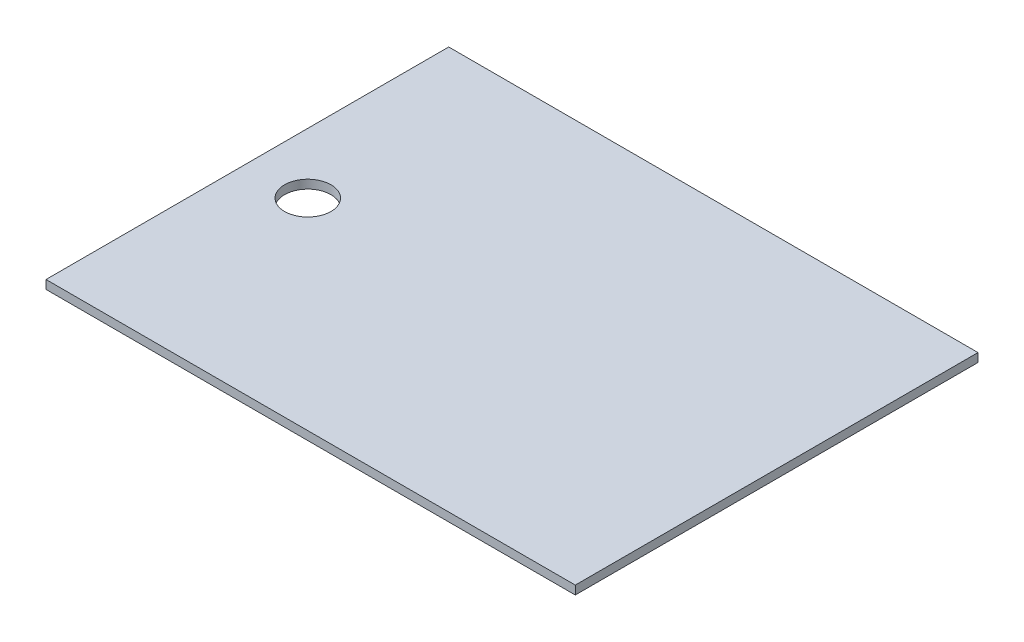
SolidWorks part; units mm, degrees
ref_plane "Front Plane" through (0, 0, 0) normal (0, 0, 1) x (1, 0, 0)
ref_plane "Top Plane" through (0, 0, 0) normal (0, 1, 0) x (1, 0, 0)
ref_plane "Right Plane" through (0, 0, 0) normal (1, 0, 0) x (0, 0, -1)
sketch "Sketch2" plane through (0, 0, 0) normal (0, 1, 0) x (1, 0, 0)
  line L1 (-584.2, 444.5) -> (584.2, 444.5)
  line L2 (-584.2, 444.5) -> (-584.2, -444.5)
  line L3 (-584.2, -444.5) -> (584.2, -444.5)
  line L4 (584.2, 444.5) -> (584.2, -444.5)
  line L5 (-584.2, 444.5) -> (584.2, -444.5) construction
  line L6 (-584.2, -444.5) -> (584.2, 444.5) construction
  point P0 (0, 0)
extrude "Boss-Extrude1" add sketch "Sketch2" along normal blind 19.05
sketch "Sketch3" plane through (0, 19.05, 0) normal (0, 1, 0) x (1, 0, 0)
  line L1 (-584.2, 444.5) -> (-584.2, -444.5) construction
  circle A0 centre (-450.85, 0) radius 51.181
  dimension "D2" = 102.362
  dimension "D1" = 133.35
extrude "Cut-Extrude1" cut sketch "Sketch3" against normal through all
equation "\"system_width\"= 7ft + 10"
equation "\"system_length\"= 8ft"
equation "\"module_board_length\"= 11.25in"
equation "\"module_board_width\"= 1.5in"
equation "\"module_board_hole\"= 0.5in"
equation "\"module_board_hole_seperation\"= 20in"
equation "\"module_top_thickness\"= 0.75in"
equation "\"module_lip_width\"= 1.5in"
equation "\"module_trim_thickness\"= 1in"
equation "\"module_trim_height\"= 14in"
equation "\"module_top_overhang\"= 4.5in"
equation "\"module_trim_angle\"= 45deg"
equation "\"step_board_length\" = 5.5in"
equation "\"step_board_width\" = 1.5in"
equation "\"system_step_length\"= 3ft"
equation "\"step_module_length\" = \"system_step_length\" - \"module_trim_thickness\""
equation "\"step_board_short_depth\" = \"step_module_length\" - \"module_lip_width\""
equation "\"step_trim_height\" = 8in"
equation "\"module_width\"= (\"system_width\" -  2* \"module_trim_thickness\") / 2"
equation "\"module_board_short_depth\"= \"module_width\" - ( 2 * \"module_board_width\" ) - \"module_lip_width\""
equation "\"system_top_length\"= \"system_length\" - \"system_step_length\""
equation "\"module_length\"= (\"system_top_length\" - \"module_trim_thickness\")/ 2"
equation "\"module_board_long_depth\"= \"module_length\" - \"module_lip_width\""
equation "\"module_board_hole_position\"= ( ( \"module_width\" - \"module_board_hole_seperation\" ) / 2 ) + \"module_board_width\"/2"
equation "\"step_module_width\" = \"module_width\""
equation "\"step_board_long_depth\" = \"step_module_width\" - (2 * \"module_board_width\") - \"module_lip_width\""
equation "\"D1@Sketch2\"=\"step_module_width\""
equation "\"D2@Sketch2\"=\"step_module_length\""
equation "\"D1@Boss-Extrude1\"=\"module_top_thickness\""
